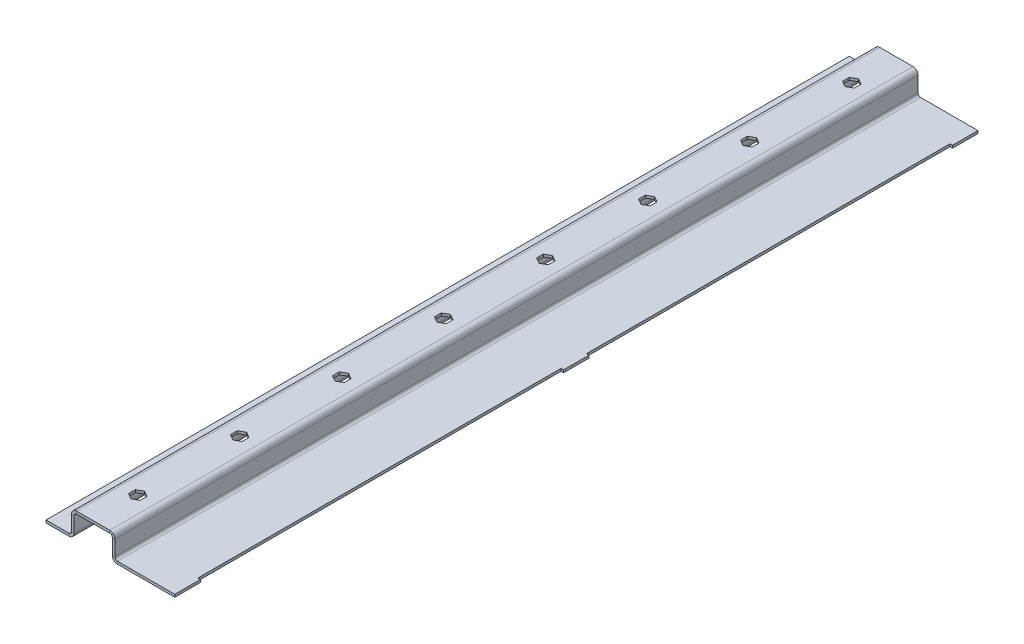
SolidWorks part; units mm, degrees
other "N" parameters "Epaisseur"=2
ref_plane "Plan de face" through (0, 0, 0) normal (0, 0, 1) x (1, 0, 0)
ref_plane "Plan de dessus" through (0, 0, 0) normal (0, 1, 0) x (1, 0, 0)
ref_plane "Plan de droite" through (0, 0, 0) normal (1, 0, 0) x (0, 0, -1)
imported_body "Importée1"
sketch "Esquisse7" plane through (0, -27, 0) normal (0, 1, 0) x (1, 0, 0)
  line L0 (19, -599.965) -> (46, -599.965) construction
  line L1 (46, 30.035) -> (37, 30.035)
  line L2 (46, 30.035) -> (46, -599.965)
  line L3 (46, -599.965) -> (37, -599.965)
  line L4 (37, 30.035) -> (37, -599.965)
  line L5 (-19, 30.035) -> (-46, 30.035) construction
  line L6 (-46, -599.965) -> (-37, -599.965)
  line L7 (-46, -599.965) -> (-46, 30.035)
  line L8 (-46, 30.035) -> (-37, 30.035)
  line L9 (-37, -599.965) -> (-37, 30.035)
  dimension "D1" = 9
  dimension "D2" = 9
extrude "Enlèv. mat.-Extru.2" cut sketch "Esquisse7" against normal up to next
sheet metal parameters "Tôlerie 1" parameters "D1"=0.1
bend "Pli issu d'un arrondi3" bend radius 2 bend angle 90 parameters "D5"=1
flatten bends "Dépliage 1" parameters "D1"=0
sketch "Esquisse-Angle1" plane through (0, -9, 0) normal (0, 1, 0) x (-1, 0, 0)
  line L0 (15.35, 599.965) -> (15.35, -30.035) construction
  line L1 (32.05, -30.035) -> (32.05, 599.965) construction
  line L2 (-15.35, -30.035) -> (-15.35, 599.965) construction
  line L3 (-32.05, 599.965) -> (-32.05, -30.035) construction
bend "Pli issu d'un arrondi1" bend radius 2 bend angle 90 parameters "D5"=4
bend "Pli issu d'un arrondi2" bend radius 2 bend angle 90 parameters "D5"=2
bend "Pli issu d'un arrondi4" bend radius 2 bend angle 90 parameters "D5"=3
process bends "Pliage 1" parameters "D1"=0
sketch "Esquisse-Plate1" plane through (0, -9, 0) normal (0, 1, 0) x (-1, 0, 0)
sketch "Esquisse5" plane through (0, -9, 0) normal (0, 1, 0) x (1, 0, 0)
  circle A0 centre (0, -565) radius 4.6 construction
  circle A1 centre (0, -484.99) radius 4.6 construction
  circle A2 centre (0, -404.98) radius 4.6 construction
  circle A3 centre (0, -324.97) radius 4.6 construction
  circle A9 centre (0, -244.96) radius 4.6 construction
  circle A10 centre (0, -164.95) radius 4.6 construction
  circle A11 centre (0, -84.94) radius 4.6 construction
  circle A12 centre (0, -4.93) radius 4.6 construction
  dimension "D1" = 9.2
  dimension "D3" = 80.01
  dimension "D2" = 8
sketch "Esquisse6" plane through (0, -9, 0) normal (0, 1, 0) x (1, 0, 0)
  line L1 (0, -570.3116) -> (4.6, -567.6558)
  line L2 (4.6, -567.6558) -> (4.6, -562.3442)
  line L3 (4.6, -562.3442) -> (0, -559.6884)
  line L4 (0, -559.6884) -> (-4.6, -562.3442)
  line L5 (-4.6, -562.3442) -> (-4.6, -567.6558)
  line L6 (-4.6, -567.6558) -> (0, -570.3116)
  line L9 (-13, -599.965) -> (-13, 30.035) construction
  circle A0 centre (0, -565) radius 4.6 construction
  circle A1 centre (0, -565) radius 4.6 construction
extrude "Enlèv. mat.-Extru.1" cut sketch "Esquisse6" against normal up to next
pattern_linear "Répétition linéaire1" count 8 spacing 80.01 along (0, 0, -1) of "Enlèv. mat.-Extru.1"
ref_plane "Plan1" through (0, 0, 284.965) normal (0, 0, 1) x (1, 0, 0)
sketch "Esquisse9" plane through (0, -27, 0) normal (0, 1, 0) x (1, 0, 0)
  line L1 (37, 30.035) -> (62, 30.035)
  line L2 (37, 30.035) -> (37, -599.965)
  line L3 (37, -599.965) -> (62, -599.965)
  line L4 (62, 30.035) -> (62, -599.965)
  dimension "D1" = 25
base flange "Patte1" sketch "Esquisse9" reverse thickness direction no parameters "D1"=0.1
sketch "Esquisse10" plane through (0, -27, 0) normal (0, 1, 0) x (-1, 0, 0)
  line L0 (-62, 599.965) -> (-62, -30.035) construction
  line L1 (-62, -30.035) -> (-64, -30.035)
  line L2 (-62, -30.035) -> (-62, -10.035)
  line L3 (-62, -10.035) -> (-64, -10.035)
  line L4 (-64, -30.035) -> (-64, -10.035)
  line L5 (-62, 599.965) -> (-64, 599.965)
  line L6 (-62, 599.965) -> (-62, 579.965)
  line L7 (-62, 579.965) -> (-64, 579.965)
  line L8 (-64, 599.965) -> (-64, 579.965)
  line L9 (-64, 274.965) -> (-62, 274.965)
  line L10 (-64, 274.965) -> (-64, 294.965)
  line L11 (-64, 294.965) -> (-62, 294.965)
  line L12 (-62, 274.965) -> (-62, 294.965)
  line L13 (-64, 274.965) -> (-62, 294.965) construction
  line L14 (-64, 294.965) -> (-62, 274.965) construction
  point P10 (-63, 284.965)
  point P17 (-62, 284.965)
  dimension "D1" = 2
  dimension "D2" = 2
  dimension "D3" = 2
  dimension "D4" = 20
base flange "Patte2" sketch "Esquisse10" reverse thickness direction no parameters "D1"=0.1
flat pattern "Etat déplié1"
sketch "Lignes de pliage1" plane through (0, -9, 0) normal (0, 1, 0) x (-1, 0, 0)
  line L0 (-32.05, -30.035) -> (-32.05, 599.965) construction
  line L1 (-15.35, -30.035) -> (-15.35, 599.965) construction
  line L2 (32.05, 599.965) -> (32.05, -30.035) construction
  line L3 (15.35, 599.965) -> (15.35, -30.035) construction
  line L4 (-32.05, -30.035) -> (-32.05, 599.965) construction
  line L5 (-15.35, -30.035) -> (-15.35, 599.965) construction
  line L6 (32.05, 599.965) -> (32.05, -30.035) construction
  line L7 (15.35, 599.965) -> (15.35, -30.035) construction
sketch3d "Cube de visualisation1" [suppressed]
  line L0 (92.8226, 14.965, 0) -> (92.8226, -615.035, 0) construction
  line L1 (-38.9773, 14.965, 0) -> (-38.9773, -615.035, 0) construction
  line L2 (92.8226, 14.965, 0) -> (-38.9773, 14.965, 0) construction
  line L3 (92.8226, -615.035, 0) -> (-38.9773, -615.035, 0) construction
bend of the flat pattern "Dépliage-<Pli issu d'un arrondi1>1"
bend of the flat pattern "Dépliage-<Pli issu d'un arrondi2>1"
bend of the flat pattern "Dépliage-<Pli issu d'un arrondi3>1"
bend of the flat pattern "Dépliage-<Pli issu d'un arrondi4>1"
